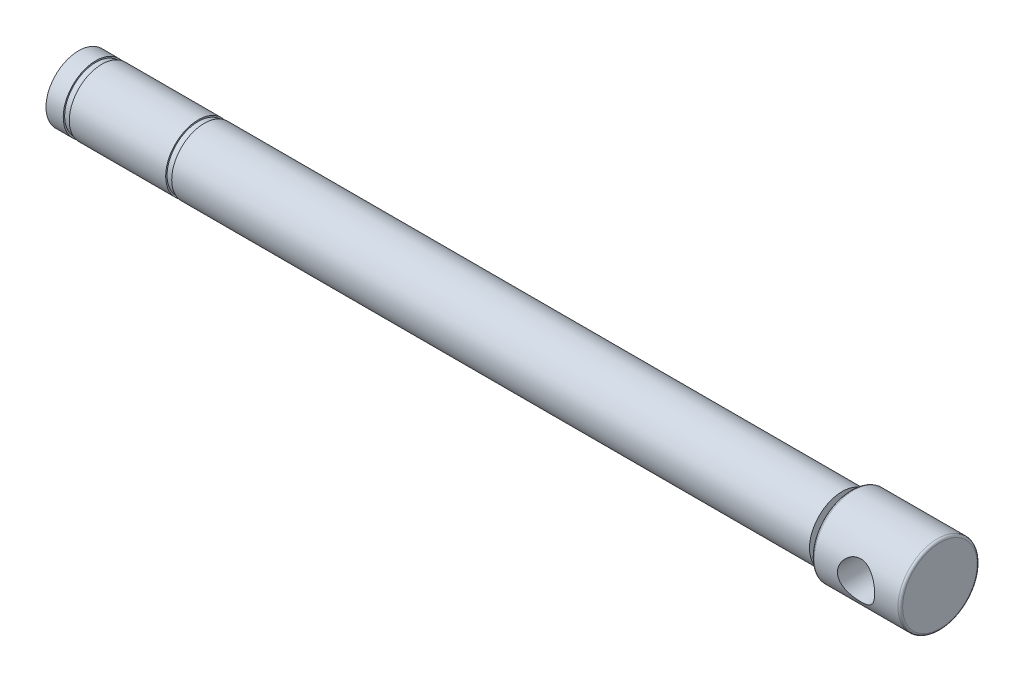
SolidWorks part; units mm, degrees
ref_plane "Front Plane" through (0, 0, 0) normal (0, 0, 1) x (1, 0, 0)
ref_plane "Top Plane" through (0, 0, 0) normal (0, 1, 0) x (1, 0, 0)
ref_plane "Right Plane" through (0, 0, 0) normal (1, 0, 0) x (0, 0, -1)
sketch "Sketch1" plane through (0, 0, 0) normal (0, 0, 1) x (1, 0, 0)
  line L0 (0, 0) -> (0, 8.5)
  line L1 (-788.9915, 0) -> (-188.1636, 0) construction
  line L2 (0, 8.5) -> (-19, 8.5)
  line L3 (-21, 7) -> (-21, 4)
  line L4 (-21, 4) -> (-19, 4)
  line L5 (-21, 7) -> (-158, 7)
  line L6 (-158, 7) -> (-158, 6.7)
  line L7 (-158, 6.7) -> (-159.3, 6.7)
  line L8 (-159.3, 6.7) -> (-159.3, 7)
  line L9 (-19, 4) -> (-19, 8.5)
  line L10 (-159.3, 7) -> (-180, 7)
  line L11 (-185, 0) -> (0, 0)
  line L12 (-147.5802, 0) -> (38660.5852, 0) construction
  line L13 (-180, 7) -> (-180, 6.7)
  line L14 (-180, 6.7) -> (-181.3, 6.7)
  line L15 (-181.3, 6.7) -> (-181.3, 7)
  line L16 (-181.3, 7) -> (-185, 7)
  line L17 (-185, 7) -> (-185, 0)
  point P9 (-181.3, 7)
  dimension "D1" = 19
  dimension "D2" = 8.5
  dimension "D3" = 14
  dimension "D4" = 13.4
  dimension "D10" = 1.3
  dimension "D5" = 180
  dimension "D6" = 185
  dimension "D8" = 158
  dimension "D9" = 2
  dimension "D7" = 1.3
  dimension "D12" = 8
revolve "Revolve1" add sketch "Sketch1" angle 360 about L1
sketch "Sketch2" plane through (0, 0, 0) normal (0, 0, 1) x (1, 0, 0)
  line L0 (-1000, 0) -> (49000, 0) construction
  line L1 (0, -1000) -> (0, 49000) construction
  circle A0 centre (-9.5, 0) radius 4
  dimension "D1" = 8
  dimension "D2" = 9.5
extrude "Cut-Extrude1" cut sketch "Sketch2" against normal through all both and the other way through all
fillet "Fillet1" radius 0.5 2 edges at (-19, 0, 8.5) (0, 0, 8.5)
